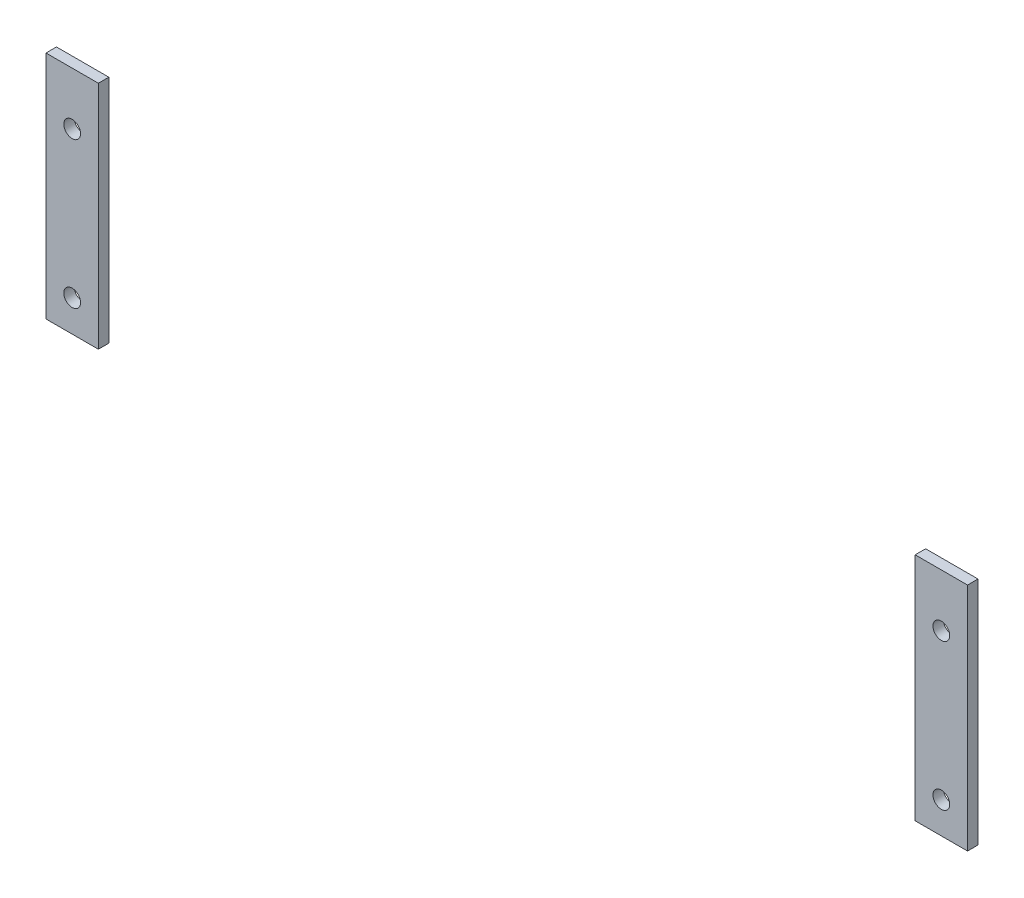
SolidWorks part; units mm, degrees
ref_plane "Plan de face" through (0, 0, 0) normal (0, 0, 1) x (1, 0, 0)
ref_plane "Plan de dessus" through (0, 0, 0) normal (0, 1, 0) x (1, 0, 0)
ref_plane "Plan de droite" through (0, 0, 0) normal (1, 0, 0) x (0, 0, -1)
ref_plane "Plan1" through (0, 0, 10) normal (0, 0, 1) x (1, 0, 0)
sketch "Esquisse22" plane through (0, 0, 10) normal (0, 0, 1) x (1, 0, 0)
  line L8 (2191.9999, -1411.8299) -> (2142, -1411.8299)
  line L9 (2142, -1411.8299) -> (2142, -1631.83)
  line L10 (2191.9999, -1631.83) -> (2191.9999, -1411.8299)
  line L11 (2142, -1631.83) -> (2191.9999, -1631.83)
  line L12 (3022.0001, -1411.8299) -> (2972.0001, -1411.8299)
  line L13 (3022.0001, -1631.83) -> (3022.0001, -1411.8299)
  line L14 (2972.0001, -1411.8299) -> (2972.0001, -1631.83)
  line L15 (2972.0001, -1631.83) -> (3022.0001, -1631.83)
  circle A4 centre (2167.0001, -1601.83) radius 8
  circle A5 centre (2167.0001, -1462.16) radius 8
  circle A6 centre (2996.999, -1462.16) radius 8
  circle A7 centre (2996.999, -1601.83) radius 8
extrude "Boss.-Extru.1" add sketch "Esquisse22" against normal blind 10
